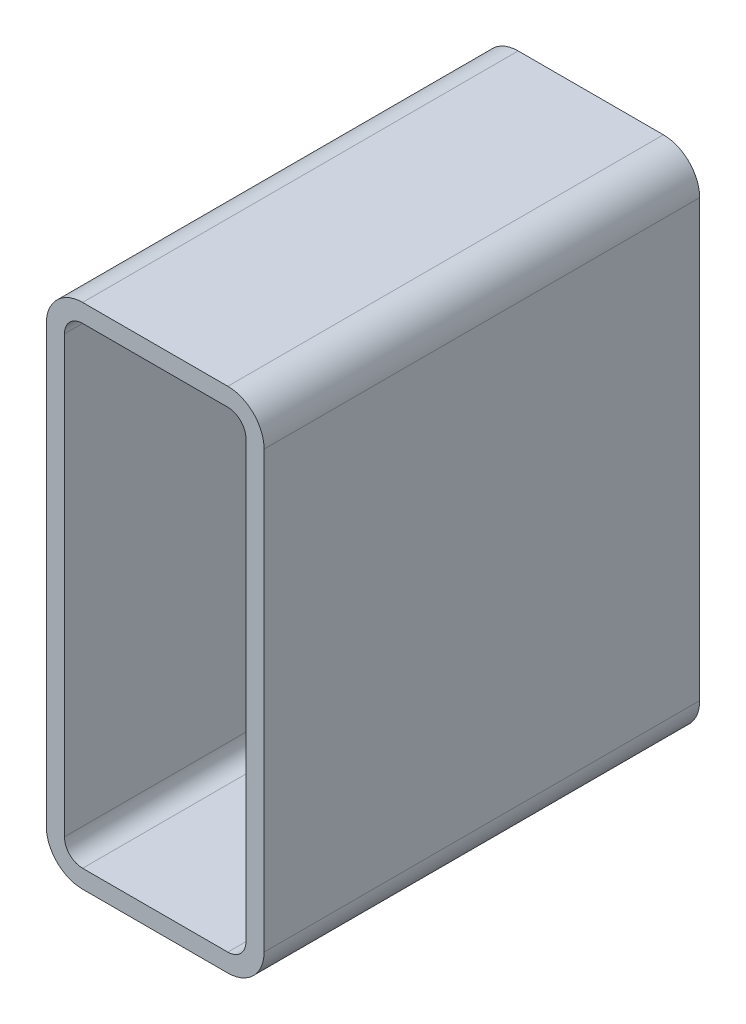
SolidWorks part; units mm, degrees
ref_plane "Front Plane" through (0, 0, 0) normal (0, 0, 1) x (1, 0, 0)
ref_plane "Top Plane" through (0, 0, 0) normal (0, 1, 0) x (1, 0, 0)
ref_plane "Right Plane" through (0, 0, 0) normal (1, 0, 0) x (0, 0, -1)
sketch "Sketch1" plane through (0, 0, 0) normal (0, 0, 1) x (1, 0, 0)
sketch_block_instance "HSS14x6x0.500-1"
sketch_block "HSS14x6x0.500"
extrude "Boss-Extrude1" add sketch "Sketch1" along normal blind 304.8
